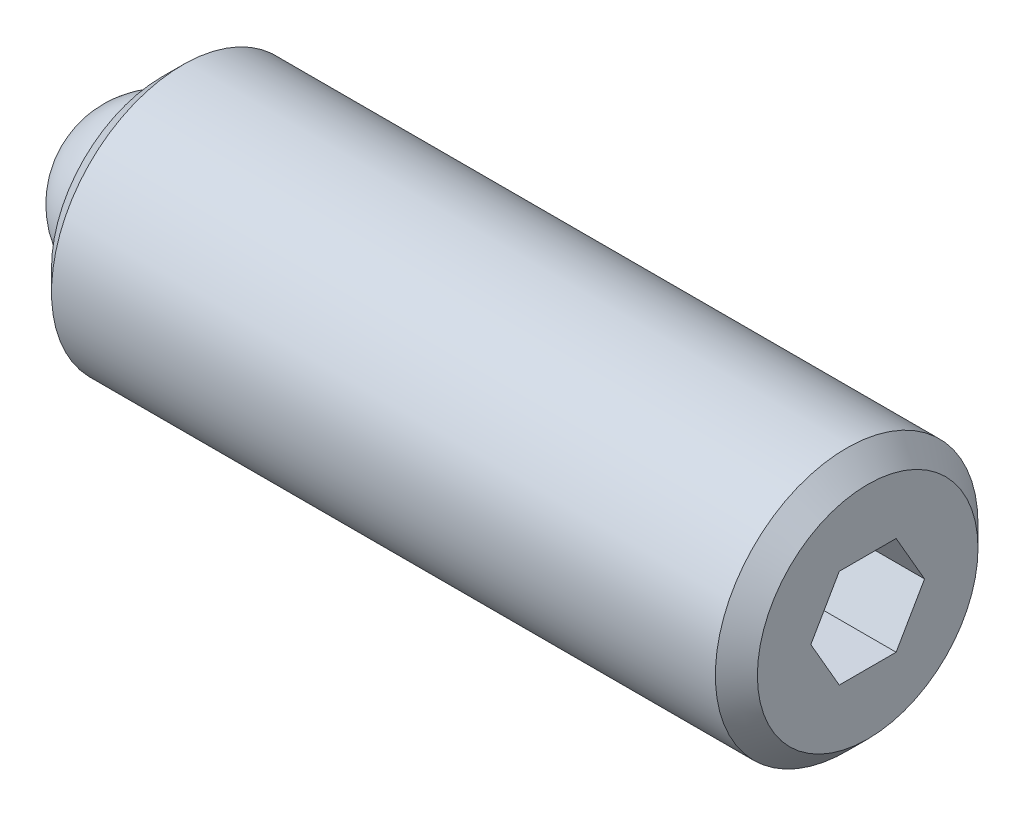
SolidWorks part; units mm, degrees
ref_plane "Front Plane" through (0, 0, 0) normal (0, 0, 1) x (1, 0, 0)
ref_plane "Top Plane" through (0, 0, 0) normal (0, 1, 0) x (1, 0, 0)
ref_plane "Right Plane" through (0, 0, 0) normal (1, 0, 0) x (0, 0, -1)
sketch "Sketch2" plane through (0, 0, 0) normal (1, 0, 0) x (0, 0, -1)
  circle A0 centre (0, 0) radius 3.175
  dimension "D1" = 6.35
extrude "Boss-Extrude1" add sketch "Sketch2" along normal blind 17.0656
sketch "Sketch3" plane through (0, 0, 0) normal (-1, 0, 0) x (0, 0, 1)
  circle A0 centre (0, 0) radius 1.9812
  dimension "D1" = 3.9624
chamfer "Chamfer1" distance 0.508 angle 45 1 edges at (0, 0, -3.175)
chamfer "Chamfer2" distance 0.508 angle 45 1 edges at (17.0656, 0, -3.175)
sketch "Sketch4" plane through (17.0656, 0, 0) normal (1, 0, 0) x (0, 0, -1)
  line L1 (1.3748, 0) -> (0.6874, 1.1906)
  line L2 (0.6874, 1.1906) -> (-0.6874, 1.1906)
  line L3 (-0.6874, 1.1906) -> (-1.3748, 0)
  line L4 (-1.3748, 0) -> (-0.6874, -1.1906)
  line L5 (-0.6874, -1.1906) -> (0.6874, -1.1906)
  line L6 (0.6874, -1.1906) -> (1.3748, 0)
  circle A0 centre (0, 0) radius 1.1906 construction
  dimension "D1" = 2.3813
extrude "Cut-Extrude2" cut sketch "Sketch4" against normal blind 2.286
extrude "Cut-Extrude3" cut sketch "Sketch3" against normal blind 1.9844
sketch "Sketch5" plane through (0, 0, 0) normal (-1, 0, 0) x (0, 0, 1)
  line L0 (0, 0) -> (0, -1.9844)
  line L1 (0, 0) -> (0, 1.9844)
  arc A0 (0, 1.9844) -> (0, -1.9844) centre (0, 0) ccw
  dimension "D1" = 1.9844
revolve "Revolve1" add sketch "Sketch5" angle 360 about L1
